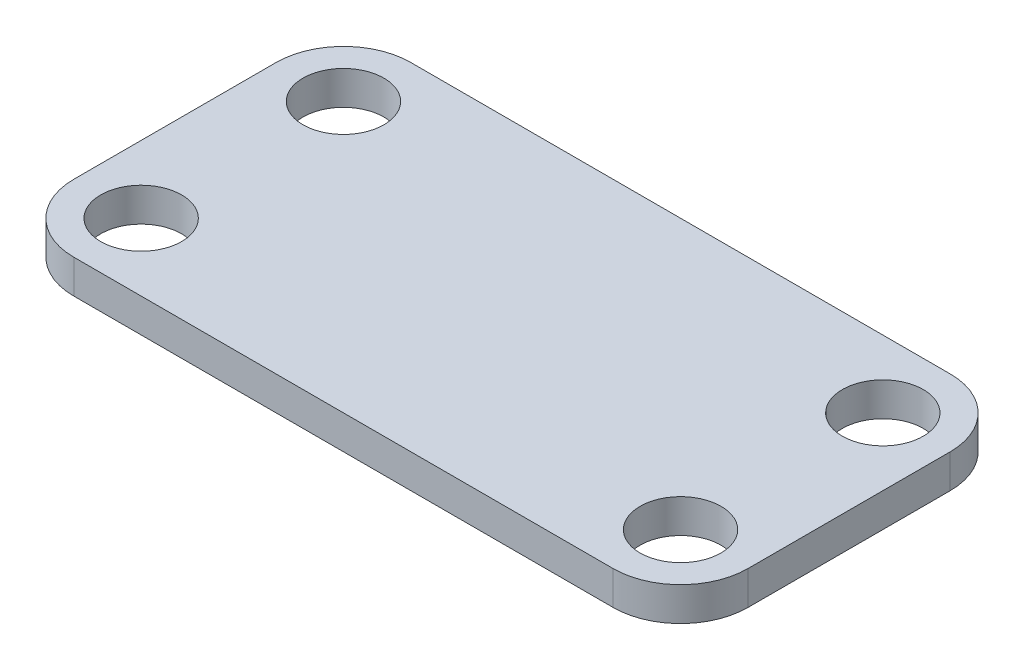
SolidWorks part; units mm, degrees
ref_plane "Front" through (0, 0, 0) normal (0, 0, 1) x (1, 0, 0)
ref_plane "Top" through (0, 0, 0) normal (0, 1, 0) x (1, 0, 0)
ref_plane "Right" through (0, 0, 0) normal (1, 0, 0) x (0, 0, -1)
sketch "Sketch1" plane through (0, 0, 0) normal (0, 1, 0) x (1, 0, 0)
  line L0 (50, 25) -> (-50, -25) construction
  line L1 (-40, 25) -> (40, 25)
  line L2 (-50, 15) -> (-50, -15)
  line L3 (-40, -25) -> (40, -25)
  line L4 (50, 15) -> (50, -15)
  arc A0 (-40, 25) -> (-50, 15) centre (-40, 15) ccw
  arc A1 (-50, -15) -> (-40, -25) centre (-40, -15) ccw
  arc A2 (40, -25) -> (50, -15) centre (40, -15) ccw
  arc A3 (40, 25) -> (50, 15) centre (40, 15) cw
  circle A4 centre (-40, 15) radius 6
  circle A5 centre (-40, -15) radius 6
  circle A6 centre (40, 15) radius 6
  circle A7 centre (40, -15) radius 6
  point P7 (-50, 25)
  point P13 (50, -25)
  dimension "D3" = 10
  dimension "D4" = 12
  dimension "D1" = 100
  dimension "D2" = 50
extrude "Extrude1" add sketch "Sketch1" along normal blind 5
sketch "Sketch2" plane through (0, 5, 0) normal (0, 1, 0) x (-1, 0, 0)
  line L0 (-40, -25) -> (40, -25) construction
  line L1 (17.5, -25) -> (-17.5, -25)
  line L2 (17.5, -25) -> (17.5, 25)
  line L3 (17.5, 25) -> (-17.5, 25)
  line L4 (-17.5, -25) -> (-17.5, 25)
  line L5 (40, 25) -> (-40, 25) construction
  line L6 (17.5, 25) -> (-17.5, -25) construction
  line L7 (13.5, -21) -> (-13.5, -21)
  line L8 (-13.5, -21) -> (-13.5, 21)
  line L9 (13.5, 21) -> (-13.5, 21)
  line L10 (13.5, -21) -> (13.5, 21)
  dimension "D2" = 35
  dimension "D1" = 4
